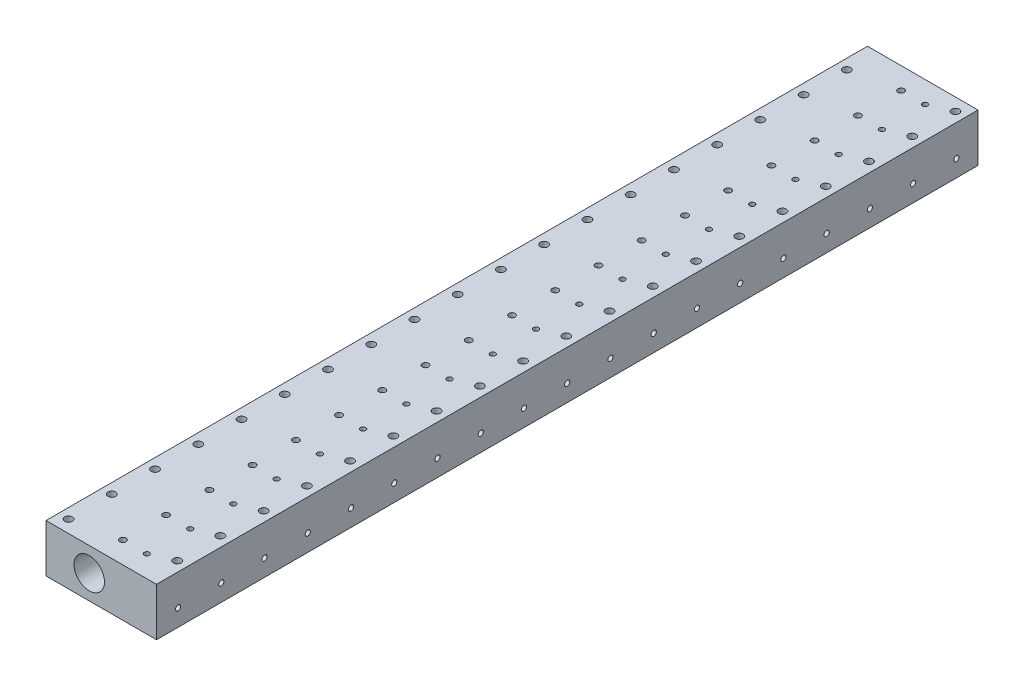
SolidWorks part; units mm, degrees
ref_plane "Front Plane" through (0, 0, 0) normal (0, 0, 1) x (1, 0, 0)
ref_plane "Top Plane" through (0, 0, 0) normal (0, 1, 0) x (1, 0, 0)
ref_plane "Right Plane" through (0, 0, 0) normal (1, 0, 0) x (0, 0, -1)
sketch "Sketch1" plane through (0, 0, 0) normal (0, 0, 1) x (1, 0, 0)
  line L1 (-11.5, -5) -> (11.5, -5)
  line L2 (-11.5, -5) -> (-11.5, 5)
  line L3 (-11.5, 5) -> (11.5, 5)
  line L4 (11.5, -5) -> (11.5, 5)
  line L5 (-11.5, -5) -> (11.5, 5) construction
  line L6 (-11.5, 5) -> (11.5, -5) construction
  point P0 (0, 0)
  dimension "D1" = 23
  dimension "D2" = 10
extrude "Boss-Extrude1" add sketch "Sketch1" against normal blind 171
hole_wizard "#55 (0.052) Diameter Hole1" positions "Sketch2" profile "Sketch4" hole size "#55" standard "ANSI Inch"
sketch "Sketch2" plane through (0, 5, 0) normal (0, 1, 0) x (1, 0, 0)
  line L0 (11.5, 0) -> (-11.5, 0) construction
  point P0 (0, 4.5)
  dimension "D1" = 4.5
sketch "Sketch4" plane through (0, 5, -4.5) normal (1, 0, 0) x (0, 0, 1)
  line L0 (0, 0) -> (0, 7.3968)
  line L1 (0, 7.3968) -> (0.6604, 7)
  line L2 (0.6604, 7) -> (0.6604, 0)
  line L5 (0.6604, 0) -> (0, 0)
  line L10 (0, 7.3968) -> (-0.6604, 7) construction
  line L11 (0, -6.35) -> (0, 107.95) construction
  dimension "Hole Dia." = 1.3208
  dimension "Hole Depth" = 7
  dimension "Drill Angle" = 118
sketch "Sketch5" plane through (0, 0, 0) normal (0, 0, 1) x (1, 0, 0)
  circle A0 centre (-2.5, 0) radius 3.175
  dimension "D2" = 6.35
  dimension "D1" = 2.5
extrude "Cut-Extrude1" cut sketch "Sketch5" against normal through all
hole_wizard "M2x0.4 Tapped Hole1" positions "Sketch6" profile "Sketch8" tap size "M2x0.4" standard "ANSI Metric"
sketch "Sketch6" plane through (0, 5, 0) normal (0, 1, 0) x (1, 0, 0)
  line L0 (0, 4.5) -> (5, 4.5) construction
  point P0 (9.4, 6.4)
  point P2 (-9.4, 2.6)
  dimension "D1" = 9.4
  dimension "D2" = 9.4
  dimension "D3" = 1.9
  dimension "D4" = 1.9
sketch "Sketch8" plane through (9.4, 5, -6.4) normal (1, 0, 0) x (0, 0, 1)
  line L0 (0, 0) -> (0, 5.6807)
  line L1 (0, 5.6807) -> (0.8, 5.2)
  line L2 (0.8, 5.2) -> (0.8, 0)
  line L5 (0.8, 0) -> (0, 0)
  line L10 (0, 5.6807) -> (-0.8, 5.2) construction
  line L11 (0, -6.35) -> (0, 107.95) construction
  dimension "Tap Drill Dia." = 1.6
  dimension "Tap Drill Depth" = 5.2
  dimension "Drill Angle" = 118
hole_wizard "#57 (0.043) Diameter Hole2" positions "Sketch11" profile "Sketch12" hole size "#57" standard "ANSI Inch"
sketch "Sketch11" plane through (11.5, 0, 0) normal (1, 0, 0) x (0, 0, -1)
  line L0 (0, -5) -> (0, 5) construction
  line L1 (171, 5) -> (0, 5) construction
  point P0 (4.5, -1.5)
  dimension "D1" = 4.5
  dimension "D2" = 6.5
sketch "Sketch12" plane through (11.5, -1.5, -4.5) normal (0, 1, 0) x (0, 0, -1)
  line L0 (0, 0) -> (0, 6.3281)
  line L1 (0, 6.3281) -> (0.5461, 6)
  line L2 (0.5461, 6) -> (0.5461, 0)
  line L5 (0.5461, 0) -> (0, 0)
  line L10 (0, 6.3281) -> (-0.5461, 6) construction
  line L11 (0, -6.35) -> (0, 107.95) construction
  dimension "Hole Dia." = 1.0922
  dimension "Hole Depth" = 6
  dimension "Drill Angle" = 118
hole_wizard "#57 (0.043) Diameter Hole1" positions "Sketch13" profile "Sketch14" hole size "#57" standard "ANSI Inch"
sketch "Sketch13" plane through (0, 5, 0) normal (0, 1, 0) x (1, 0, 0)
  line L0 (0, 4.5) -> (5, 4.5)
  point P0 (5, 4.5)
  dimension "D1" = 5
sketch "Sketch14" plane through (5, 5, -4.5) normal (1, 0, 0) x (0, 0, 1)
  line L0 (0, 0) -> (0, 7.8281)
  line L1 (0, 7.8281) -> (0.5461, 7.5)
  line L2 (0.5461, 7.5) -> (0.5461, 0)
  line L5 (0.5461, 0) -> (0, 0)
  line L10 (0, 7.8281) -> (-0.5461, 7.5) construction
  line L11 (0, -6.35) -> (0, 107.95) construction
  dimension "Hole Dia." = 1.0922
  dimension "Hole Depth" = 7.5
  dimension "Drill Angle" = 118
pattern_linear "LPattern1" count 19 spacing 9 along (0, 0, -1) of "#55 (0.052) Diameter Hole1", "M2x0.4 Tapped Hole1", "#57 (0.043) Diameter Hole2", "#57 (0.043) Diameter Hole1"
